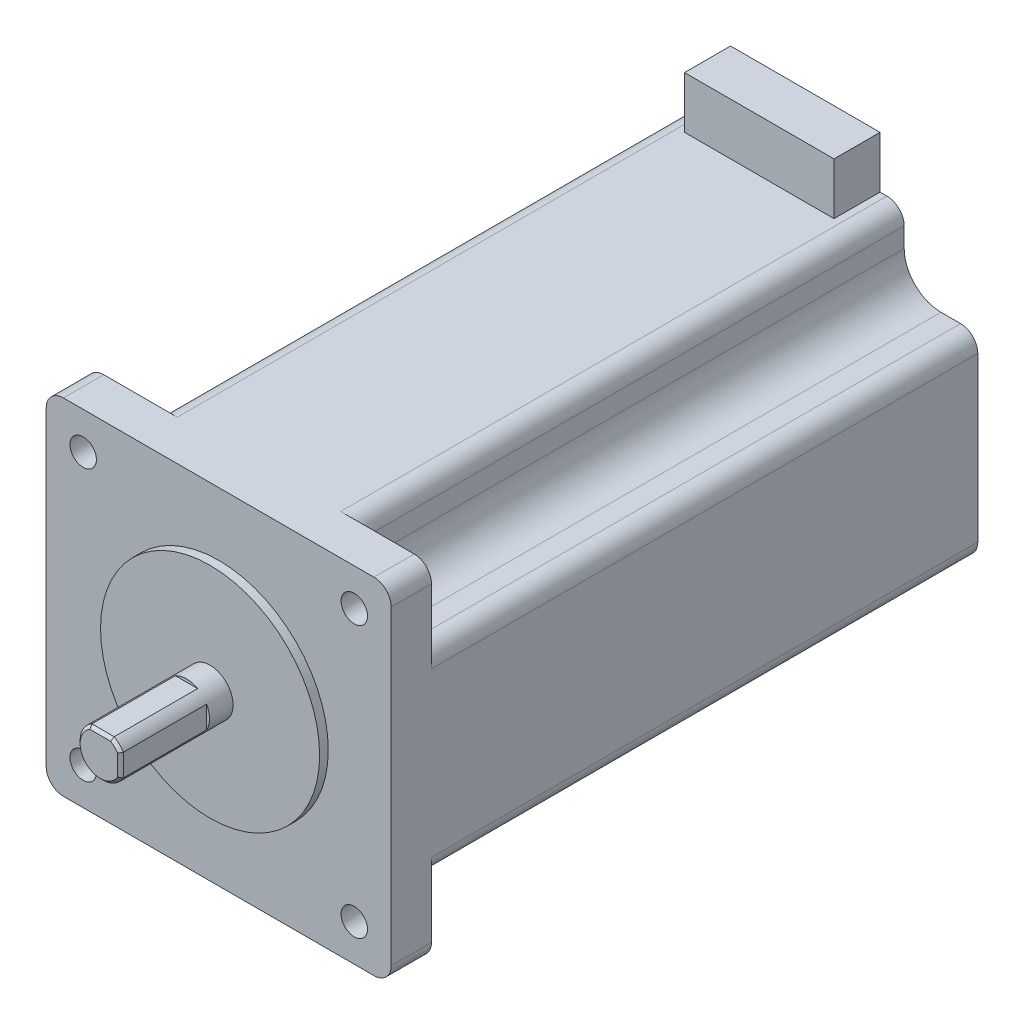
SolidWorks part; units mm, degrees
ref_plane "前视基准面" through (0, 0, 0) normal (0, 0, 1) x (1, 0, 0)
ref_plane "上视基准面" through (0, 0, 0) normal (0, 1, 0) x (1, 0, 0)
ref_plane "右视基准面" through (0, 0, 0) normal (1, 0, 0) x (0, 0, -1)
sketch "草图1" plane through (0, 0, 0) normal (0, 0, 1) x (1, 0, 0)
  circle A0 centre (0, 0) radius 19.05
extrude "凸台-拉伸1" add sketch "草图1" against normal blind 1.5
sketch "草图2" plane through (0, 0, 0) normal (0, 0, 1) x (1, 0, 0)
  circle A0 centre (0, 0) radius 4
extrude "凸台-拉伸2" add sketch "草图2" along normal blind 19.1
sketch "草图3" plane through (0, 0, 19.1) normal (0, 0, 1) x (1, 0, 0)
  line L0 (3.5, 0) -> (3.5, -4)
  line L1 (0, 3.5) -> (3, 3.5)
  line L2 (3, 3.5) -> (3, 6.1575)
  line L3 (3, 6.1575) -> (-4, 6.1575)
  line L4 (-4, 6.1575) -> (-4, 3.5)
  line L5 (-4, 3.5) -> (0, 3.5)
  line L7 (3.5, -4) -> (7.6659, -4)
  line L8 (7.6659, -4) -> (7.6659, 3.5)
  line L9 (7.6659, 3.5) -> (3.5, 3.5)
  line L10 (3.5, 3.5) -> (3.5, 0)
extrude "切除-拉伸1" cut sketch "草图3" against normal blind 15
chamfer "倒角1" distance 0.5 angle 45 4 edges at (0, 3.5, 19.1) (2.8284, 2.8284, 19.1) (-2.8284, -2.8284, 19.1) (3.5, 0, 19.1)
sketch "草图4" plane through (0, 0, -1.5) normal (0, 0, -1) x (-1, 0, 0)
  line L1 (0, 30) -> (27, 30)
  line L2 (30, 27) -> (30, -27)
  line L3 (27, -30) -> (-27, -30)
  line L4 (-30, -27) -> (-30, 27)
  line L5 (-27, 30) -> (0, 30)
  arc A0 (-27, -30) -> (-30, -27) centre (-27, -27) cw
  arc A1 (30, -27) -> (27, -30) centre (27, -27) cw
  arc A2 (27, 30) -> (30, 27) centre (27, 27) cw
  arc A3 (-30, 27) -> (-27, 30) centre (-27, 27) cw
  circle A4 centre (23.57, 23.57) radius 2.3
  circle A5 centre (23.57, -23.57) radius 2.3
  circle A6 centre (-23.57, -23.57) radius 2.3
  circle A7 centre (-23.57, 23.57) radius 2.3
  dimension "D1" = 3
extrude "凸台-拉伸3" add sketch "草图4" along normal blind 102
sketch "草图5" plane through (0, 0, -103.5) normal (0, 0, -1) x (-1, 0, 0)
  line L1 (27, 30) -> (-27, 30) construction
  line L2 (10.2835, 30) -> (14.2, 30)
  line L3 (17.2, 27) -> (17.2, 23.6)
  line L4 (23.6, 17.2) -> (27, 17.2)
  line L5 (-10.2835, 39.1307) -> (-10.2835, 30)
  line L6 (30, -27) -> (30, 27) construction
  line L7 (30, 14.2) -> (30, 9.8667)
  line L8 (30, 9.8667) -> (35.4123, 9.8667)
  line L9 (35.4123, 9.8667) -> (35.4123, 39.1307)
  line L10 (35.4123, 39.1307) -> (10.2835, 39.1307)
  line L11 (10.2835, 39.1307) -> (10.2835, 30)
  line L13 (-35.4123, 39.1307) -> (-10.2835, 39.1307)
  line L14 (-35.4123, 9.8667) -> (-35.4123, 39.1307)
  line L15 (-30, 9.8667) -> (-35.4123, 9.8667)
  line L16 (-30, 14.2) -> (-30, 9.8667)
  line L17 (-23.6, 17.2) -> (-27, 17.2)
  line L18 (-17.2, 27) -> (-17.2, 23.6)
  line L19 (-10.2835, 30) -> (-14.2, 30)
  line L20 (10.2835, -39.1307) -> (10.2835, -30)
  line L21 (35.4123, -39.1307) -> (10.2835, -39.1307)
  line L22 (35.4123, -9.8667) -> (35.4123, -39.1307)
  line L23 (30, -9.8667) -> (35.4123, -9.8667)
  line L24 (30, -14.2) -> (30, -9.8667)
  line L25 (23.6, -17.2) -> (27, -17.2)
  line L26 (17.2, -27) -> (17.2, -23.6)
  line L27 (10.2835, -30) -> (14.2, -30)
  line L28 (-10.2835, -30) -> (-14.2, -30)
  line L29 (-17.2, -27) -> (-17.2, -23.6)
  line L30 (-23.6, -17.2) -> (-27, -17.2)
  line L31 (-30, -14.2) -> (-30, -9.8667)
  line L32 (-30, -9.8667) -> (-35.4123, -9.8667)
  line L33 (-35.4123, -9.8667) -> (-35.4123, -39.1307)
  line L34 (-35.4123, -39.1307) -> (-10.2835, -39.1307)
  line L35 (-10.2835, -39.1307) -> (-10.2835, -30)
  arc A0 (17.2, 23.6) -> (23.6, 17.2) centre (23.6, 23.6) ccw
  arc A1 (27, 17.2) -> (30, 14.2) centre (27, 14.2) cw
  arc A2 (14.2, 30) -> (17.2, 27) centre (14.2, 27) cw
  arc A3 (-14.2, 30) -> (-17.2, 27) centre (-14.2, 27) ccw
  arc A4 (-27, 17.2) -> (-30, 14.2) centre (-27, 14.2) ccw
  arc A5 (-17.2, 23.6) -> (-23.6, 17.2) centre (-23.6, 23.6) cw
  arc A6 (14.2, -30) -> (17.2, -27) centre (14.2, -27) ccw
  arc A7 (27, -17.2) -> (30, -14.2) centre (27, -14.2) ccw
  arc A8 (17.2, -23.6) -> (23.6, -17.2) centre (23.6, -23.6) cw
  arc A9 (-17.2, -23.6) -> (-23.6, -17.2) centre (-23.6, -23.6) ccw
  arc A10 (-27, -17.2) -> (-30, -14.2) centre (-27, -14.2) cw
  arc A11 (-14.2, -30) -> (-17.2, -27) centre (-14.2, -27) cw
  point P20 (30, 17.2)
  point P23 (17.2, 30)
  point P38 (-17.2, 30)
  point P39 (-30, 17.2)
  point P54 (17.2, -30)
  point P55 (30, -17.2)
  point P70 (-30, -17.2)
  point P71 (-17.2, -30)
  dimension "D1" = 6.4
  dimension "D2" = 3
extrude "切除-拉伸2" cut sketch "草图5" against normal blind 95
sketch "草图6" plane through (0, 0, -103.5) normal (0, 0, -1) x (-1, 0, 0)
  line L0 (0, 30) -> (13, 30)
  line L1 (14.2, 30) -> (-14.2, 30) construction
  line L2 (13, 30) -> (13, 39)
  line L3 (13, 39) -> (-13, 39)
  line L4 (-13, 39) -> (-13, 30)
  line L5 (-13, 30) -> (0, 30)
extrude "凸台-拉伸4" add sketch "草图6" against normal blind 8 separate body
